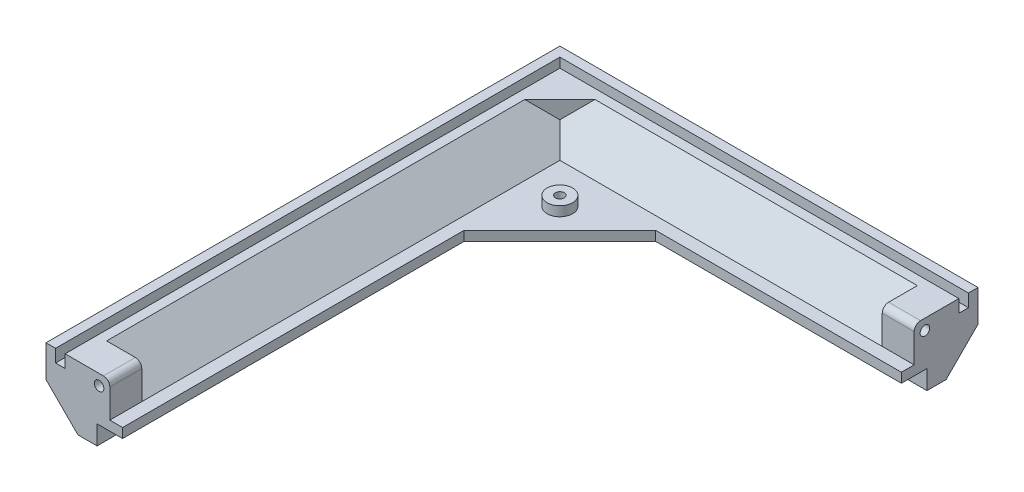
SolidWorks part; units mm, degrees
ref_plane "Front Plane" through (0, 0, 0) normal (0, 0, 1) x (1, 0, 0)
ref_plane "Top Plane" through (0, 0, 0) normal (0, 1, 0) x (1, 0, 0)
ref_plane "Right Plane" through (0, 0, 0) normal (1, 0, 0) x (0, 0, -1)
sketch "Sketch2" plane through (0, 0, 6.5477) normal (0, 0, 1) x (1, 0, 0)
  line L0 (-60.0579, -10) -> (-60.0579, 0)
  line L2 (-57.0579, -4) -> (-54.0579, -4)
  line L7 (-60.0579, -10) -> (-50.0579, -10) construction
  line L8 (-50.0579, -10) -> (-50.0579, -20) construction
  line L9 (-50.0579, -20) -> (-60.0579, -10)
  line L10 (-50.0579, -20) -> (-40.0579, -20)
  line L11 (-40.0579, -20) -> (-40.0579, -17)
  line L12 (-40.0579, -17) -> (-44.0579, -17)
  line L13 (-44.0579, -17) -> (-44.0579, -14)
  line L14 (-44.0579, -14) -> (-40.0579, -14)
  line L15 (-40.0579, -14) -> (-40.0579, -11)
  line L26 (-57.0579, 0) -> (-57.0579, -4)
  line L27 (-54.0579, -4) -> (-54.0579, 0)
  line L29 (-40.0579, -11) -> (-51.0579, 0)
  line L30 (-60.0579, 0) -> (-57.0579, 0)
  line L31 (-54.0579, 0) -> (-51.0579, 0)
  line L32 (0, 0) -> (-51.0579, 0) construction
extrude "Boss-Extrude2" add sketch "Sketch2" along normal blind 141 separate body
sketch "Sketch3" plane through (-40.0579, 0, 0) normal (1, 0, 0) x (0, 0, -1)
  line L1 (-6.5477, -14) -> (-2.5477, -14)
  line L2 (-2.5477, -14) -> (-2.5477, -17)
  line L3 (-2.5477, -17) -> (-6.5477, -17)
  line L4 (-6.5477, -17) -> (-6.5477, -20)
  line L5 (-6.5477, -20) -> (3.4523, -20)
  line L7 (7.4523, -4) -> (10.4523, -4)
  line L11 (13.4523, -10) -> (3.4523, -20)
  line L21 (-6.5477, -14) -> (-6.5477, -11)
  line L22 (13.4523, -10) -> (13.4523, 0)
  line L23 (13.4523, 0) -> (10.4523, 0)
  line L24 (10.4523, 0) -> (10.4523, -4)
  line L25 (7.4523, -4) -> (7.4523, 0)
  line L26 (7.4523, 0) -> (4.4523, 0)
  line L27 (4.4523, 0) -> (-6.5477, -11)
extrude "Boss-Extrude3" add sketch "Sketch3" along normal blind 111 separate body
sketch "Sketch17" plane through (0, 0, 0) normal (0, 1, 0) x (1, 0, 0)
  line L0 (-60.0579, -6.5477) -> (-60.0579, 19.5864) construction
  line L1 (-40.0579, 13.4523) -> (-60.0579, 13.4523)
  line L2 (-60.0579, 13.4523) -> (-60.0579, -6.5477)
  line L3 (-60.0579, -6.5477) -> (-40.0579, -6.5477)
  line L4 (-40.0579, -6.5477) -> (-40.0579, 13.4523)
extrude "Boss-Extrude9" add sketch "Sketch17" against normal blind 20
sketch "Sketch8" plane through (-40.0579, 0, 0) normal (1, 0, 0) x (0, 0, -1)
  line L0 (-2.5477, -14) -> (-2.5477, -17)
  line L1 (-2.5477, -17) -> (-6.5477, -17)
  line L2 (-6.5477, -17) -> (-6.5477, -14)
  line L3 (-6.5477, -14) -> (-2.5477, -14)
extrude "Cut-Extrude4" cut sketch "Sketch8" against normal blind 4
sketch "Sketch9" plane through (-40.0579, 0, 0) normal (1, 0, 0) x (0, 0, -1)
  line L4 (7.4523, -4) -> (10.4523, -4)
  line L5 (10.4523, -4) -> (10.4523, 0)
  line L6 (10.4523, 0) -> (7.4523, 0)
  line L7 (7.4523, 0) -> (7.4523, -4)
extrude "Cut-Extrude5" cut sketch "Sketch9" against normal blind 17
sketch "Sketch18" plane through (0, 0, 6.5477) normal (0, 0, 1) x (1, 0, 0)
  line L0 (-57.0579, -4) -> (-57.0579, 0)
  line L1 (-57.0579, 0) -> (-54.0579, 0)
  line L2 (-54.0579, 0) -> (-54.0579, -4)
  line L3 (-54.0579, -4) -> (-57.0579, -4)
extrude "Cut-Extrude9" cut sketch "Sketch18" against normal blind 14
sketch "Sketch11" plane through (0, 0, 0) normal (0, 1, 0) x (1, 0, 0)
  line L3 (-40.0579, 4.4523) -> (-51.0579, -6.5477)
  line L4 (-51.0579, -6.5477) -> (-40.0579, -6.5477)
  line L5 (-51.0579, -6.5477) -> (-40.0579, -6.5477) construction
  line L6 (-40.0579, -6.5477) -> (-40.0579, 4.4523) construction
  line L7 (-40.0579, -6.5477) -> (-40.0579, 4.4523)
extrude "Cut-Extrude7" cut sketch "Sketch11" against normal blind 11
sketch "Sketch12" plane through (-40.0579, 0, 0) normal (-1, 0, 0) x (0, 0, 1)
  line L3 (-4.4523, 0) -> (6.5477, -11)
  line L4 (6.5477, -11) -> (-4.4523, -11)
  line L5 (-4.4523, -11) -> (-4.4523, 0)
extrude "Boss-Extrude5" add sketch "Sketch12" along normal blind 10
sketch "Sketch13" plane through (0, 0, 6.5477) normal (0, 0, -1) x (-1, 0, 0)
  line L0 (40.0579, -11) -> (51.0579, -11)
  line L1 (51.0579, -11) -> (51.0579, 0)
  line L2 (51.0579, 0) -> (40.0579, -11)
extrude "Boss-Extrude6" add sketch "Sketch13" along normal blind 10
sketch "Sketch14" plane through (0, -17, 0) normal (0, 1, 0) x (1, 0, 0)
  line L0 (-44.0579, -2.5477) -> (-44.0579, -147.5477)
  line L1 (-44.0579, -147.5477) -> (-40.0579, -147.5477)
  line L2 (-40.0579, -147.5477) -> (-40.0579, -6.5477)
  line L3 (-40.0579, -6.5477) -> (70.9421, -6.5477)
  line L4 (70.9421, -6.5477) -> (70.9421, -2.5477)
  line L5 (70.9421, -2.5477) -> (-44.0579, -2.5477)
extrude "Cut-Extrude8" cut sketch "Sketch14" against normal through all
sketch "Sketch15" plane through (0, 0, 6.5477) normal (0, 0, 1) x (1, 0, 0)
  line L4 (-40.0579, -14) -> (-40.0579, -11)
  line L5 (-40.0579, -11) -> (70.9421, -11)
  line L6 (70.9421, -11) -> (70.9421, -14)
  line L7 (70.9421, -14) -> (-40.0579, -14)
extrude "Boss-Extrude7" add sketch "Sketch15" along normal blind 4
sketch "Sketch16" plane through (-40.0579, 0, 0) normal (1, 0, 0) x (0, 0, -1)
  line L0 (-10.5477, -14) -> (-10.5477, -11)
  line L1 (-10.5477, -11) -> (-147.5477, -11)
  line L2 (-147.5477, -11) -> (-147.5477, -14)
  line L3 (-147.5477, -14) -> (-10.5477, -14)
extrude "Boss-Extrude8" add sketch "Sketch16" along normal blind 4
chamfer "Chamfer1" distance 30 angle 45 1 edges at (-36.0579, -12.5, 10.5477)
sketch "Sketch19" plane through (-40.0579, 0, 0) normal (1, 0, 0) x (0, 0, -1)
  line L0 (13.4523, -10) -> (3.4523, -20)
  line L1 (3.4523, -20) -> (13.4523, -20)
  line L2 (13.4523, -20) -> (13.4523, -10)
extrude "Cut-Extrude10" cut sketch "Sketch19" against normal through all
sketch "Sketch20" plane through (0, 0, 6.5477) normal (0, 0, 1) x (1, 0, 0)
  line L0 (-50.0579, -20) -> (-60.0579, -10)
  line L1 (-60.0579, -10) -> (-60.0579, -20)
  line L2 (-60.0579, -20) -> (-50.0579, -20)
extrude "Cut-Extrude11" cut sketch "Sketch20" against normal through all
chamfer "Chamfer2" distance 20 angle 45 1 edges at (-44.0579, -17, 2.5477)
sketch "Sketch21" plane through (0, -14, 0) normal (0, -1, 0) x (1, 0, 0)
  line L0 (-21.0579, 25.5477) -> (-34.0579, 12.5477) construction
  line L3 (-6.0579, 10.5477) -> (-36.0579, 40.5477) construction
  line L4 (-44.0579, 22.5477) -> (-24.0579, 2.5477) construction
  circle A0 centre (-27.5579, 19.0477) radius 1.4
extrude "Cut-Extrude12" cut sketch "Sketch21" against normal through all
sketch "Sketch22" plane through (70.9421, 0, 0) normal (1, 0, 0) x (0, 0, -1)
  line L0 (-1.0477, -5.5) -> (-3.1691, -3.3787) construction
  line L1 (-6.5477, -11) -> (-6.5477, 0)
  line L2 (4.4523, 0) -> (-6.5477, -11)
  line L3 (-6.5477, 0) -> (4.4523, 0)
  circle A0 centre (-3.1691, -3.3787) radius 1.5
extrude "Boss-Extrude10" add sketch "Sketch22" against normal blind 10
sketch "Sketch23" plane through (0, 0, 147.5477) normal (0, 0, 1) x (1, 0, 0)
  line L0 (-45.5579, -5.5) -> (-43.4365, -3.3787) construction
  line L3 (-40.0579, -11) -> (-51.0579, 0)
  line L4 (-51.0579, 0) -> (-40.0579, 0) construction
  line L5 (-40.0579, 0) -> (-40.0579, -11) construction
  line L6 (-51.0579, 0) -> (-40.0579, 0)
  line L7 (-40.0579, 0) -> (-40.0579, -11)
  circle A0 centre (-43.4365, -3.3787) radius 1.5
extrude "Boss-Extrude11" add sketch "Sketch23" against normal blind 10
fillet "Fillet1" radius 2 2 edges at (65.9421, 0, 6.5477) (-40.0579, 0, 142.5477)
sketch "Esquisse1" plane through (0, -11, 0) normal (0, 1, 0) x (1, 0, 0)
  circle A0 centre (-27.5579, -19.0477) radius 1.4
  circle A1 centre (-27.5579, -19.0477) radius 4
extrude "Boss.-Extru.1" add sketch "Esquisse1" along normal blind 3
